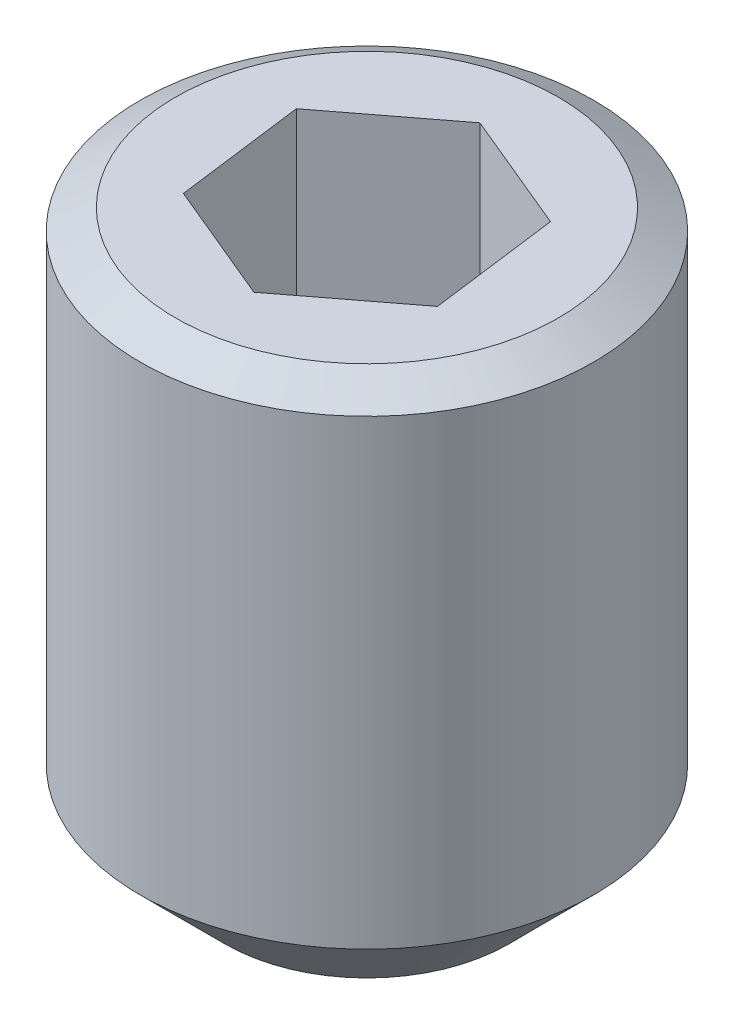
SolidWorks part; units mm, degrees
ref_plane "Face" through (0, 0, 0) normal (0, 0, 1) x (1, 0, 0)
ref_plane "Dessus" through (0, 0, 0) normal (0, 1, 0) x (1, 0, 0)
ref_plane "Droite" through (0, 0, 0) normal (1, 0, 0) x (0, 0, -1)
sketch "Esquisse1" plane through (0, 0, 0) normal (0, 0, 1) x (1, 0, 0)
  line L0 (0, 0) -> (0, 75.6418) construction
  line L1 (0, 0) -> (2.5, 0)
  line L2 (2.5, 0) -> (4, 1.5)
  line L3 (4, 1.5) -> (4, 9.6392)
  line L4 (4, 9.6392) -> (3.375, 10)
  line L5 (3.375, 10) -> (0, 10)
  line L6 (0, 10) -> (0, 0)
  dimension "D1" = 45
  dimension "Lg Chanfrein" = 1.5
  dimension "D3" = 30
  dimension "D Chanfrein" = 6.75
  dimension "D extérieur" = 8
  dimension "Longueur" = 10
revolve "Révolution1" add sketch "Esquisse1" angle 360 about L0
sketch "Esquisse2" plane through (0, 10, 0) normal (0, 1, 0) x (-1, 0, 0)
  line L1 (1.8345, 1.4028) -> (-0.2977, 2.2901)
  line L2 (-0.2977, 2.2901) -> (-2.1321, 0.8873)
  line L3 (-2.1321, 0.8873) -> (-1.8345, -1.4028)
  line L4 (-1.8345, -1.4028) -> (0.2977, -2.2901)
  line L5 (0.2977, -2.2901) -> (2.1321, -0.8873)
  line L6 (2.1321, -0.8873) -> (1.8345, 1.4028)
  circle A0 centre (0, 0) radius 2 construction
  dimension "Lg sur plat" = 4
extrude "Enlèv. mat.-Extru.1" cut sketch "Esquisse2" against normal blind 5
